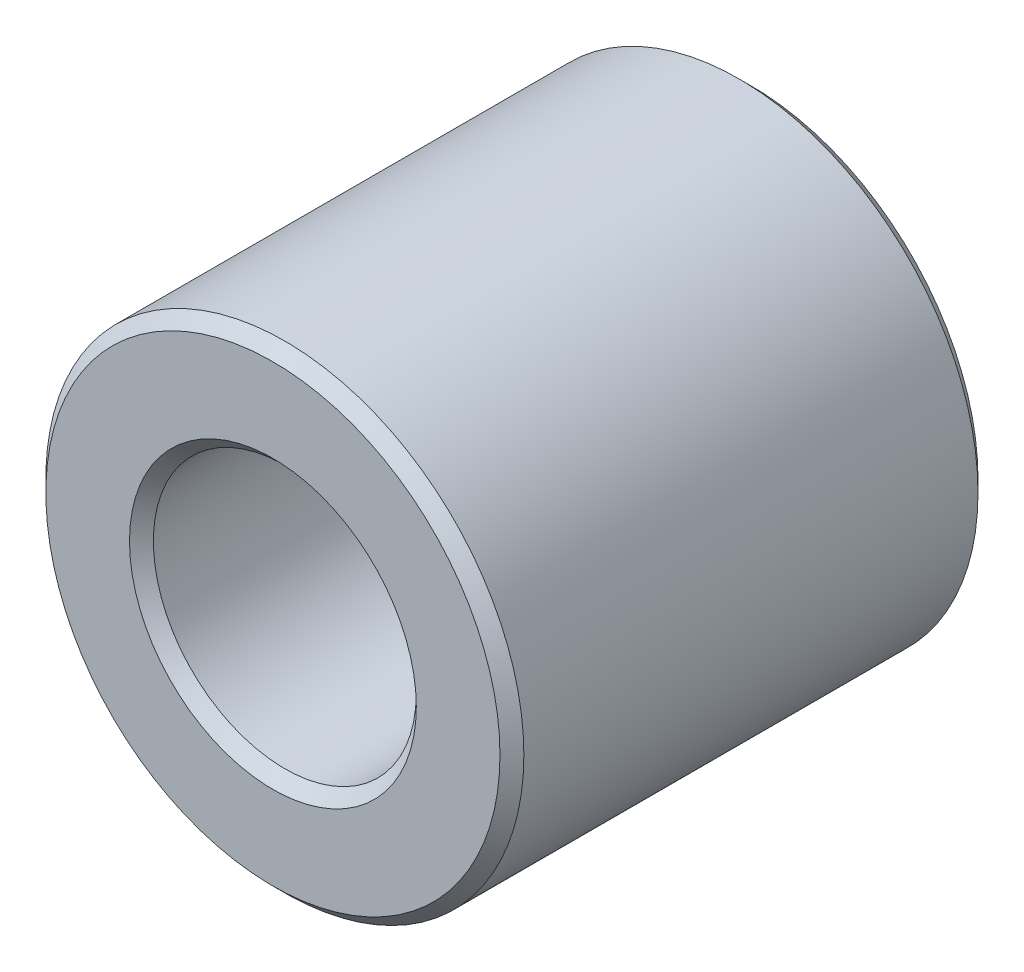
SolidWorks part; units mm, degrees
ref_plane "Front Plane" through (0, 0, 0) normal (0, 0, 1) x (1, 0, 0)
ref_plane "Top Plane" through (0, 0, 0) normal (0, 1, 0) x (1, 0, 0)
ref_plane "Right Plane" through (0, 0, 0) normal (1, 0, 0) x (0, 0, -1)
sketch "Sketch1" plane through (0, 0, 0) normal (0, 0, 1) x (1, 0, 0)
  circle A0 centre (0, 0) radius 2
  circle A1 centre (0, 0) radius 1.1
  dimension "D1" = 4
  dimension "D2" = 2.2
extrude "Boss-Extrude2" add sketch "Sketch1" along normal mid plane 4
chamfer "Chamfer3" distance 0.1 angle 45 4 edges at (2, 0, 2) (2, 0, -2) (1.1, 0, -2) (1.1, 0, 2)
